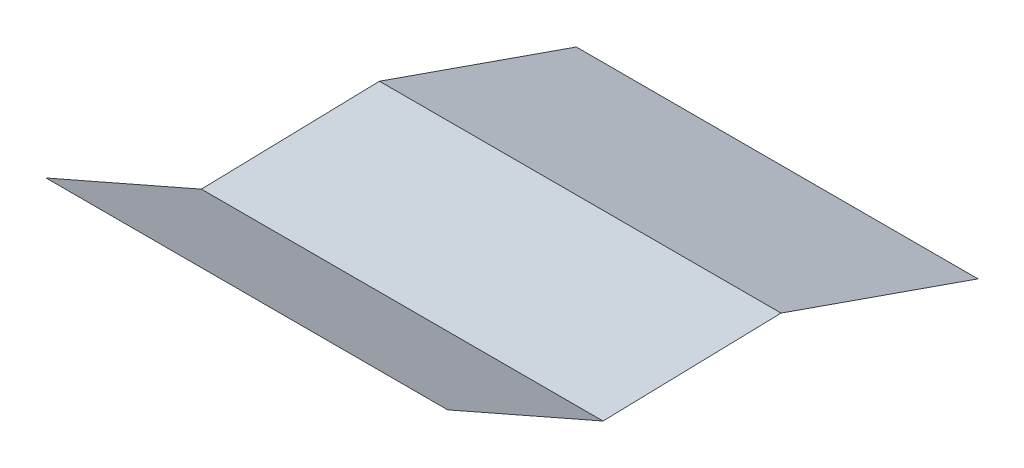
SolidWorks part; units mm, degrees
ref_plane "xy" through (0, 0, 0) normal (0, 0, 1) x (1, 0, 0)
ref_plane "xz" through (0, 0, 0) normal (0, 1, 0) x (1, 0, 0)
ref_plane "yz" through (0, 0, 0) normal (1, 0, 0) x (0, 0, -1)
sketch "Skizze1" plane through (0, 0, 0) normal (1, 0, 0) x (0, 0, -1)
  line L0 (-57.6445, 16.5138) -> (0, -15.8984)
  line L1 (0, -15.8984) -> (66.0553, -14.2573)
  line L2 (66.0553, -14.2573) -> (139.0991, -39.773)
surface "Oberfläche-Linear austragen1" sketch "Skizze1" parameters "D1"=149
other "Fläche löschen1" [suppressed]
sketch3d "3D-Skizze1"
  line L0 (99.4798, -21.5076, -86.8108) -> (0, -36.9529, -131.0262) construction
  line L1 (99.4798, -21.5076, -86.8108) -> (97.1346, -14.2573, -66.0553) construction
  line L2 (92.3419, -15.4049, -19.8626) -> (97.1346, -14.2573, -66.0553) construction
  line L3 (92.3419, -15.4049, -19.8626) -> (105.6964, -15.8984, 0) construction
  line L4 (133.2967, 0.7232, 29.5612) -> (105.6964, -15.8984, 0) construction
  line L5 (26.7801, 16.5138, 57.6445) -> (133.2967, 0.7232, 29.5612) construction
  line L6 (99.4798, -21.5076, -86.8108) -> (0, -36.9529, -131.0262)
  line L7 (99.4798, -21.5076, -86.8108) -> (97.1346, -14.2573, -66.0553)
  line L8 (92.3419, -15.4049, -19.8626) -> (97.1346, -14.2573, -66.0553)
  line L9 (92.3419, -15.4049, -19.8626) -> (105.6964, -15.8984, 0)
  line L10 (133.2967, 0.7232, 29.5612) -> (105.6964, -15.8984, 0)
  line L11 (26.7801, 16.5138, 57.6445) -> (133.2967, 0.7232, 29.5612)
